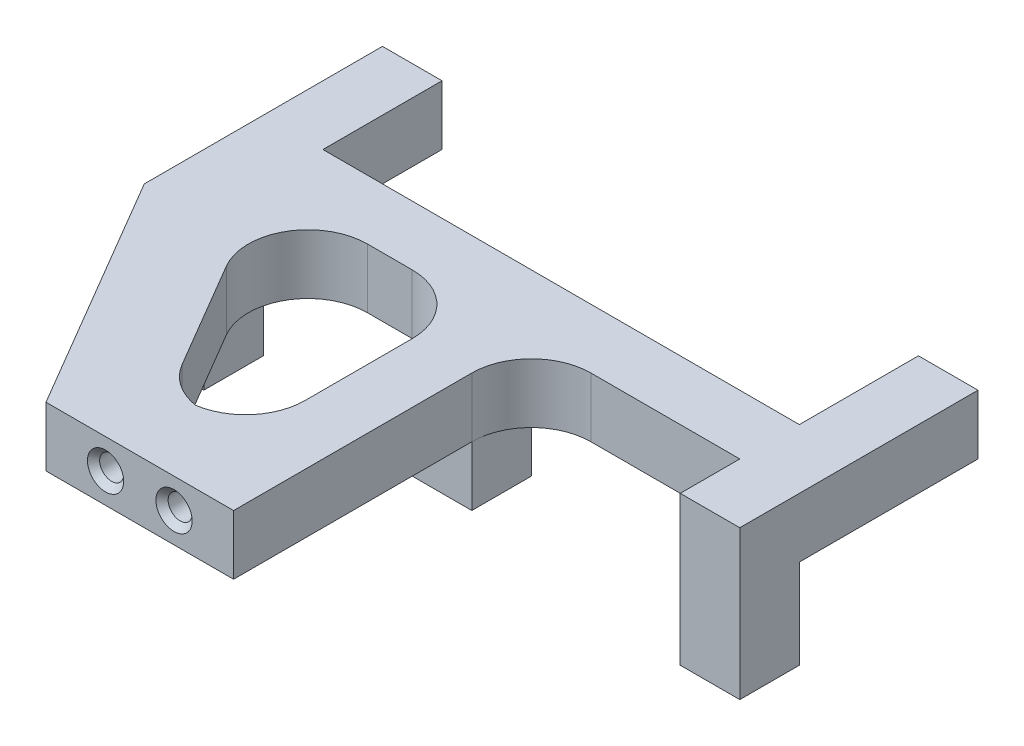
SolidWorks part; units mm, degrees
other "<Base>-<#10-32 Tapped Hole1>"
ref_plane "Front Plane" through (0, 0, 0) normal (0, 0, 1) x (1, 0, 0)
ref_plane "Top Plane" through (0, 0, 0) normal (0, 1, 0) x (1, 0, 0)
ref_plane "Right Plane" through (0, 0, 0) normal (1, 0, 0) x (0, 0, -1)
ref_plane "Front Plane-Base_Mirrored" through (0, 0, 0) normal (0, 0, 1) x (-1, 0, 0)
ref_plane "Top Plane-Base_Mirrored" through (0, 0, 0) normal (0, 1, 0) x (-1, 0, 0)
ref_plane "Right Plane-Base_Mirrored" through (0, 0, 0) normal (-1, 0, 0) x (0, 0, -1)
sketch "Sketch1-Base_Mirrored" plane through (0, 0, 0) normal (0, 0, -1) x (-1, 0, 0)
  line L1 (0, 0) -> (10, 0)
  line L2 (0, 0) -> (0, 10)
  line L3 (0, 10) -> (10, 10)
  line L4 (10, 0) -> (10, 10)
  line L5 (0, 0) -> (10, 10) construction
  line L6 (0, 10) -> (10, 0) construction
  point P4 (5, 5)
  dimension "D1" = 10
ref_plane "Midplane-Base_Mirrored" through (-5, 0, 0) normal (-1, 0, 0) x (0, 0, -1)
sketch "Sketch2-Base_Mirrored" plane through (-5, 0, 0) normal (1, 0, 0) x (0, 0, -1)
  line L1 (0, 10) -> (10, 10)
  line L2 (0, 10) -> (0, 0)
  line L3 (0, 0) -> (10, 0)
  line L4 (10, 10) -> (10, 0)
  line L5 (0, 10) -> (10, 0) construction
  line L6 (0, 0) -> (10, 10) construction
  point P4 (5, 5)
  dimension "D1" = 10
sketch "Sketch3-Base_Mirrored" plane through (0, 0, 0) normal (0, 1, 0) x (-1, 0, 0)
  line L1 (0, 0) -> (10, 0)
  line L2 (0, 0) -> (0, 10)
  line L3 (0, 10) -> (10, 10)
  line L4 (10, 0) -> (10, 10)
  line L5 (0, 0) -> (10, 10) construction
  line L6 (0, 10) -> (10, 0) construction
  point P4 (5, 5)
  dimension "D1" = 10
sketch "Sketch4-Base_Mirrored" plane through (0, 10, 0) normal (0, -1, 0) x (-1, 0, 0)
  line L1 (-45, 0) -> (-35, 0)
  line L2 (-45, 0) -> (-45, -10)
  line L3 (-45, -10) -> (-35, -10)
  line L4 (-35, 0) -> (-35, -10)
  line L5 (-45, 0) -> (-35, -10) construction
  line L6 (-45, -10) -> (-35, 0) construction
  point P4 (-40, -5)
  dimension "D1" = 10
sketch "Sketch5-Base_Mirrored" plane through (0, 0, -10) normal (0, 0, 1) x (1, 0, 0)
  line L1 (-55, 10) -> (-45, 10)
  line L2 (-55, 10) -> (-55, 0)
  line L3 (-55, 0) -> (-45, 0)
  line L4 (-45, 10) -> (-45, 0)
  line L5 (-55, 10) -> (-45, 0) construction
  line L6 (-55, 0) -> (-45, 10) construction
  point P4 (-50, 5)
sketch "Sketch7-Base_Mirrored" plane through (0, 0, 50) normal (0, 0, -1) x (-1, 0, 0)
  line L1 (10, 10) -> (31.5, 10)
  line L2 (10, 10) -> (10, 0)
  line L3 (10, 0) -> (31.5, 0)
  line L4 (31.5, 10) -> (31.5, 0)
  line L5 (10, 10) -> (31.5, 0) construction
  line L6 (10, 0) -> (31.5, 10) construction
  point P4 (20.75, 5)
ref_plane "Plane2-Base_Mirrored" through (0, 5, 0) normal (0, -1, 0) x (1, 0, 0)
sketch "Sketch12-Base_Mirrored" plane through (0, 10, 0) normal (0, -1, 0) x (-1, 0, 0)
  line L0 (31.5, -50) -> (55, -10)
  line L1 (22.675, -38) -> (45, 0)
  line L4 (22.675, -38) -> (31.5, -50)
  line L5 (45, 0) -> (55, -10)
mirrored part "Base_Mirrored" parameters "D1.Boss-Extrude1"=50, "D1.Sketch1"=10, "D1.Boss-Extrude2"=100, "D1.Sketch2"=10, "D1.Boss-Extrude3"=10, "D1.Sketch3"=10, "D1.Boss-Extrude4"=25, "D1.Sketch4"=10, "D1.Boss-Extrude5"=20, "D1.Boss-Extrude6"=12, "D1.Sketch7"=31.5, "D1.Fillet1"=10, "D2.Hole Thread2"=4.826, "D1.Hole Thread2"=28, "D2.Hole Thread1"=4.826, "D1.Hole Thread1"=12, "Tap Drill Dia..Sketch10"=4.0386, "Tap Drill Depth.Sketch10"=30, "Near C'Sink Dia..Sketch10"=6.096, "Near C'Sink Angle.Sketch10"=90, "Drill Angle.Sketch10"=118
